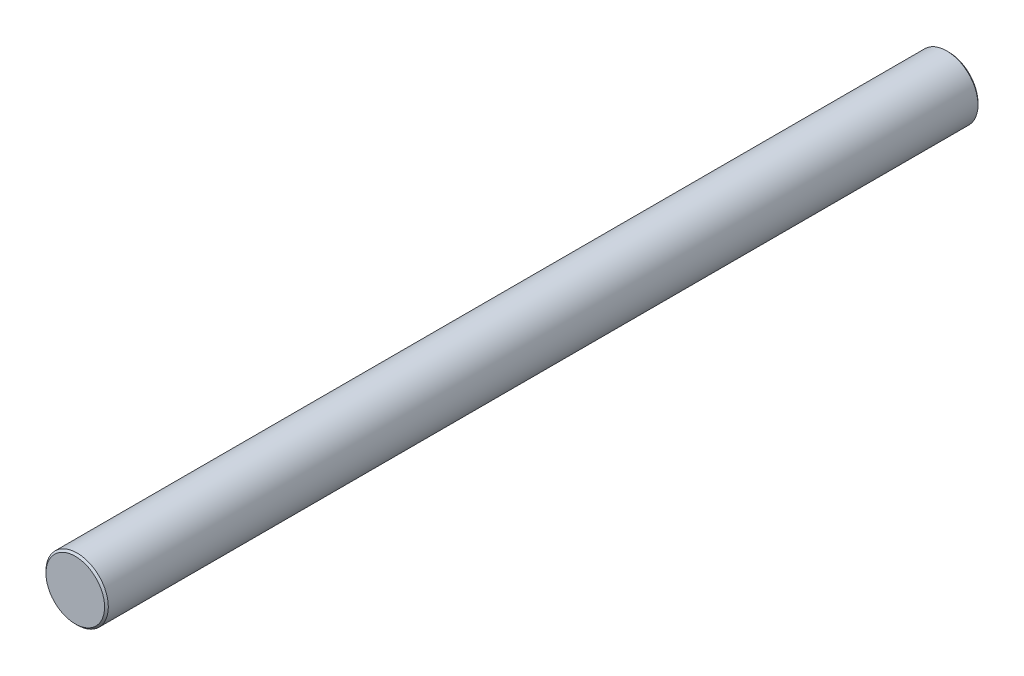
SolidWorks part; units mm, degrees
ref_plane "Front/Back" through (0, 0, 0) normal (0, 0, 1) x (1, 0, 0)
ref_plane "Top/Bottom" through (0, 0, 0) normal (0, 1, 0) x (1, 0, 0)
ref_plane "Right/Left" through (0, 0, 0) normal (1, 0, 0) x (0, 0, -1)
sketch "Sketch2" plane through (0, 0, 0) normal (0, 0, 1) x (1, 0, 0)
  circle A0 centre (0, 0) radius 12.7
  dimension "D1" = 25.4
extrude "Extrude2" add sketch "Sketch2" along normal blind 355.6
chamfer "Chamfer1" distance 0.762 angle 45 2 edges at (12.7, 0, 0) (12.7, 0, 355.6)
